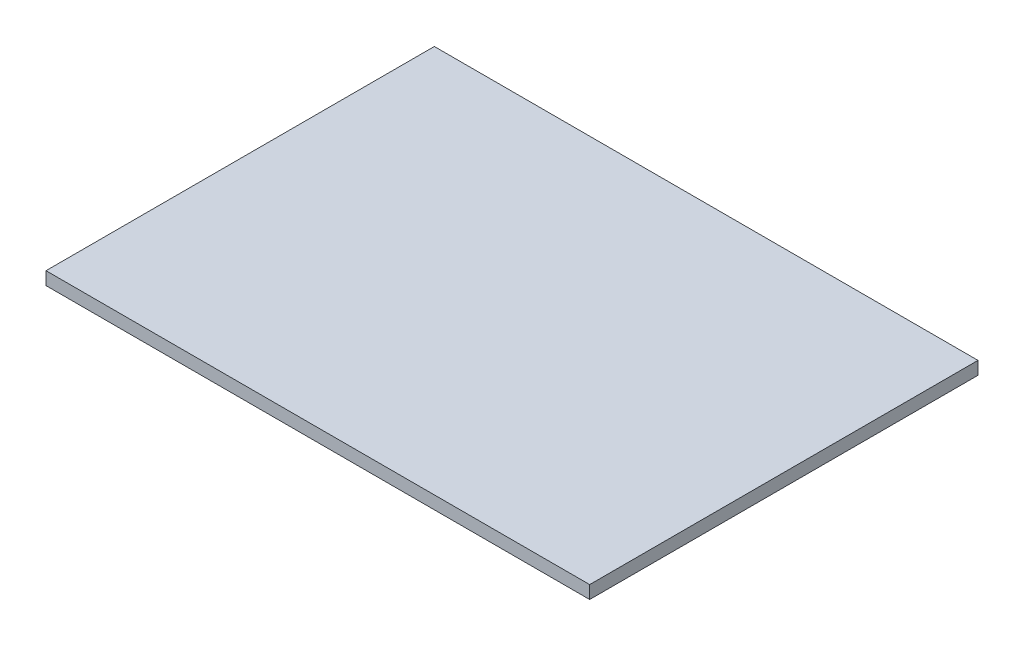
SolidWorks part; units mm, degrees
ref_plane "Front" through (0, 0, 0) normal (0, 0, 1) x (1, 0, 0)
ref_plane "Top" through (0, 0, 0) normal (0, 1, 0) x (1, 0, 0)
ref_plane "Right" through (0, 0, 0) normal (1, 0, 0) x (0, 0, -1)
sketch "Sketch1" plane through (0, 0, 0) normal (0, 1, 0) x (1, 0, 0)
  line L1 (-21, -15) -> (21, -15)
  line L2 (-21, -15) -> (-21, 15)
  line L3 (-21, 15) -> (21, 15)
  line L4 (21, -15) -> (21, 15)
  line L5 (-21, -15) -> (21, 15) construction
  line L6 (-21, 15) -> (21, -15) construction
  point P0 (0, 0)
  dimension "D1" = 42
  dimension "D2" = 30
extrude "Boss-Extrude1" add sketch "Sketch1" along normal mid plane 1
